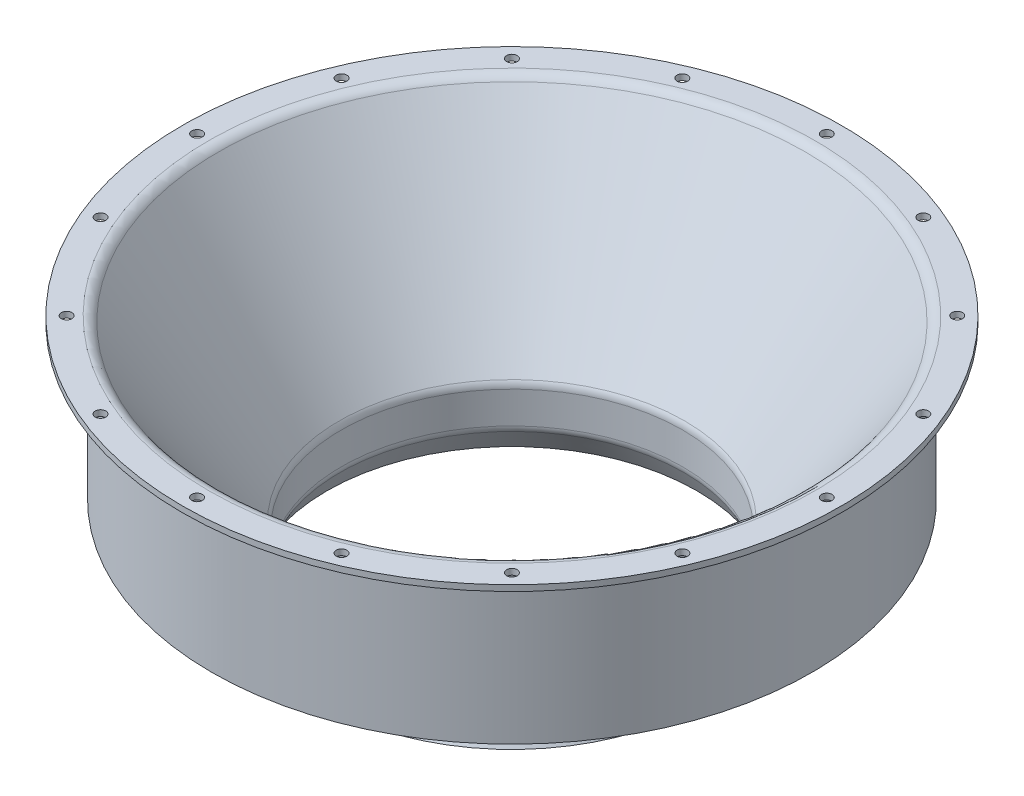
SolidWorks part; units mm, degrees
ref_plane "前视基准面" through (0, 0, 0) normal (0, 0, 1) x (1, 0, 0)
ref_plane "上视基准面" through (0, 0, 0) normal (0, 1, 0) x (1, 0, 0)
ref_plane "右视基准面" through (0, 0, 0) normal (1, 0, 0) x (0, 0, -1)
sketch "草图1" plane through (0, 0, 0) normal (0, 0, 1) x (1, 0, 0)
  line L0 (-280, 0) -> (-255, 0)
  line L1 (-255, 0) -> (-150, -150)
  line L2 (-150, -150) -> (-150, -180)
  line L3 (-150, -180) -> (-161.547, -200)
  line L4 (-280, 5) -> (-252.3967, 5)
  line L5 (-252.3967, 5) -> (-145, -148.4239)
  line L6 (-145, -148.4239) -> (-145, -181.3397)
  line L7 (-145, -181.3397) -> (-157.2169, -202.5)
  line L8 (-280, 5) -> (-280, 0)
  line L9 (-161.547, -200) -> (-157.2169, -202.5)
  line L10 (0, 0) -> (0, -210.4797) construction
  dimension "D1" = 150
  dimension "D2" = 150
  dimension "D3" = 150
  dimension "D4" = 200
  dimension "D5" = 30
  dimension "D6" = 5
  dimension "D7" = 280
  dimension "D8" = 25
revolve "旋转1" add sketch "草图1" angle 360 about L10
fillet "圆角1" radius 10 3 edges at (0, 5, 252.3967) (0, -181.3397, 145) (0, -148.4239, 145)
sketch "草图2" plane through (0, 0, 0) normal (0, 0, 1) x (1, 0, 0)
  line L0 (0, 73.7144) -> (0, -300.2969) construction
  line L1 (-255, 0) -> (-255, -130)
  line L2 (-255, -130) -> (-164, -130)
  line L3 (-255, 0) -> (-150, -150) construction
  line L4 (-164, -130) -> (-167.5, -125)
  line L5 (-255, 0) -> (255, 0) construction
  line L6 (-250, -7.1429) -> (-250, -125)
  line L7 (-250, -125) -> (-167.5, -125)
  line L9 (-250, -15.8618) -> (-250, -125) construction
  line L10 (-250, -125) -> (-173.6033, -125) construction
  line L11 (-173.6033, -125) -> (-250, -15.8618) construction
  line L12 (-250, -7.1429) -> (-255, 0)
  line L13 (-164, -130) -> (-255, 0) construction
  dimension "D1" = 130
  dimension "D2" = 5
revolve "旋转2" add sketch "草图2" angle 360 about L0
hole_wizard "孔1" positions "草图4" profile "草图3" legacy
sketch "草图4" plane through (0, 5, 0) normal (0, 1, 0) x (-1, 0, 0)
  point P0 (0, 267.5)
  dimension "D1" = 267.5
sketch "草图3" plane through (0, 5, 267.5) normal (1, 0, 0) x (0, 0, 1)
  line L0 (0, 0) -> (0, 207.5)
  line L1 (0, 207.5) -> (4.5, 207.5)
  line L2 (4.5, 207.5) -> (4.5, 0)
  line L3 (4.5, 0) -> (0, 0)
  line L4 (0, 110) -> (0, -10) construction
  dimension "直径" = 9
  dimension "深度" = 207.5
pattern_circular "阵列(圆周)1" count 16 over 360 about axis through (0, 0, 0) along (0, 1, 0) of "孔1"
